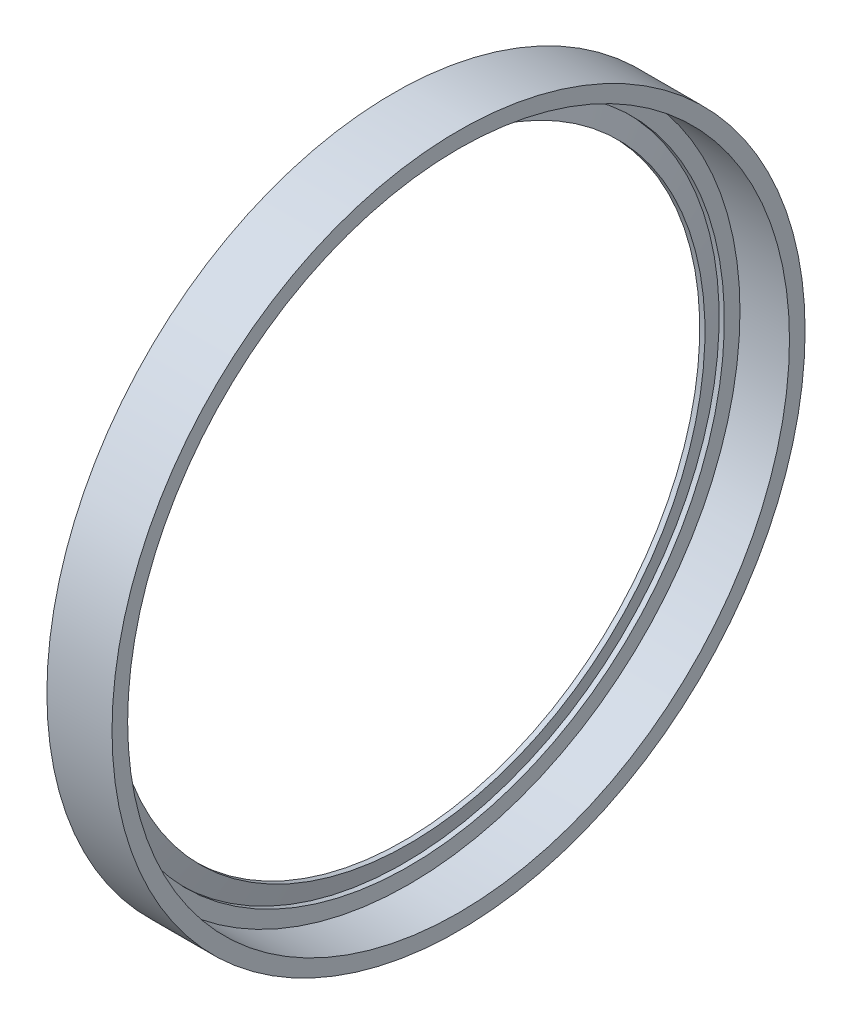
SolidWorks part; units mm, degrees
ref_plane "Front" through (0, 0, 0) normal (0, 0, 1) x (1, 0, 0)
ref_plane "Top" through (0, 0, 0) normal (0, 1, 0) x (1, 0, 0)
ref_plane "Right" through (0, 0, 0) normal (1, 0, 0) x (0, 0, -1)
sketch "Sketch1" plane through (0, 0, 0) normal (0, 0, 1) x (1, 0, 0)
  line L0 (0, 33.7947) -> (6.35, 33.7947)
  line L1 (6.35, 33.7947) -> (6.35, 32.2707)
  line L2 (6.35, 32.2707) -> (1.524, 32.2707)
  line L3 (1.524, 32.2707) -> (1.524, 30.7467)
  line L4 (0, 30.7467) -> (0.508, 30.7467)
  line L5 (0.508, 30.7467) -> (1.016, 28.8544)
  line L6 (1.016, 28.8544) -> (1.524, 28.8544)
  line L7 (0, 30.7467) -> (0, 33.7947)
  line L8 (-57.8018, 0) -> (58.3931, 0) construction
  line L9 (1.524, 28.8544) -> (1.016, 30.7467)
  line L10 (1.016, 30.7467) -> (1.524, 30.7467)
  line L11 (0, 32.2707) -> (1.524, 32.2707) construction
  dimension "D1" = 57.7088
  dimension "D2" = 67.5894
  dimension "D3" = 6.35
  dimension "D4" = 1.524
revolve "Revolve1" add sketch "Sketch1" angle 360 about L8
